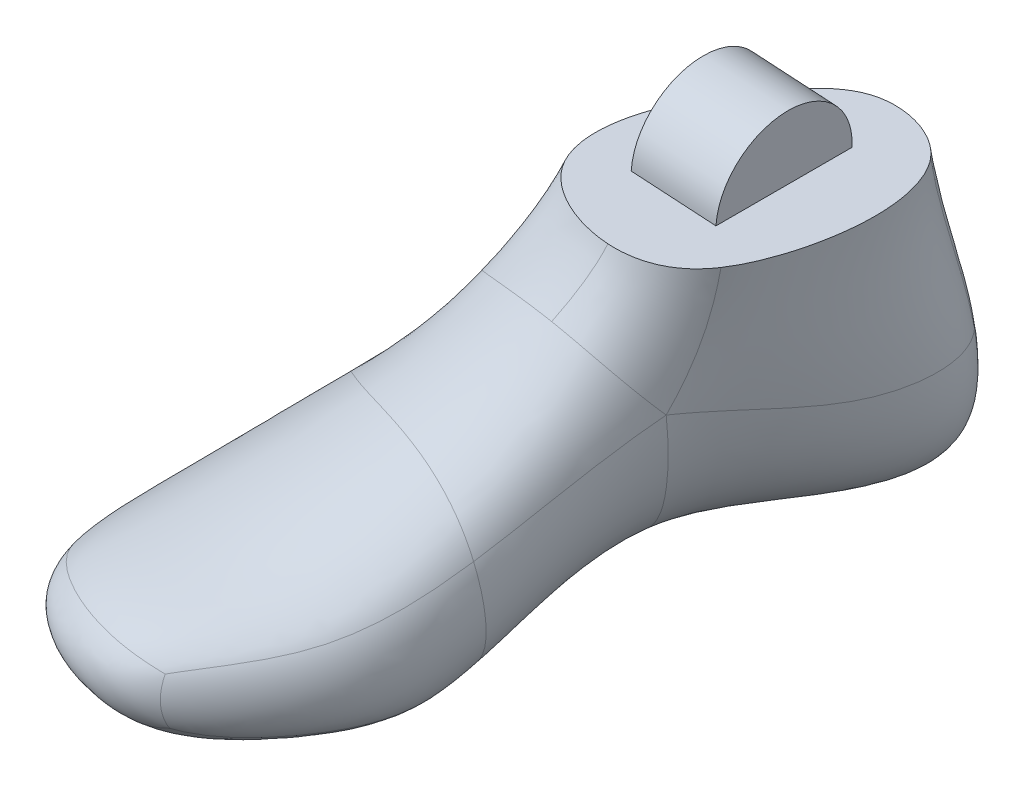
SolidWorks part; units mm, degrees
ref_plane "Front Plane" through (0, 0, 0) normal (0, 0, 1) x (1, 0, 0)
ref_plane "Top Plane" through (0, 0, 0) normal (0, 1, 0) x (1, 0, 0)
ref_plane "Right Plane" through (0, 0, 0) normal (1, 0, 0) x (0, 0, -1)
imported_body "Stock-Source-1"
sketch "Sketch1" plane through (0, 0, 0) normal (0, 0, 1) x (1, 0, 0)
  line L0 (-236.7521, 2862.5259) -> (-205.0976, 2860.625)
  line L1 (-236.7521, 2862.5259) -> (-235.2295, 2887.8802)
  line L2 (-205.0976, 2860.625) -> (-203.575, 2885.9793)
  line L3 (-235.2295, 2887.8802) -> (-203.575, 2885.9793)
  line L4 (-218.6631, 2861.4396) -> (-254.8411, 2863.6122) construction
  line L5 (-191.5321, 2859.8103) -> (-218.6631, 2861.4396) construction
  dimension "D1" = 25.4
revolve "Revolve1" add sketch "Sketch1" angle 360 about L0
